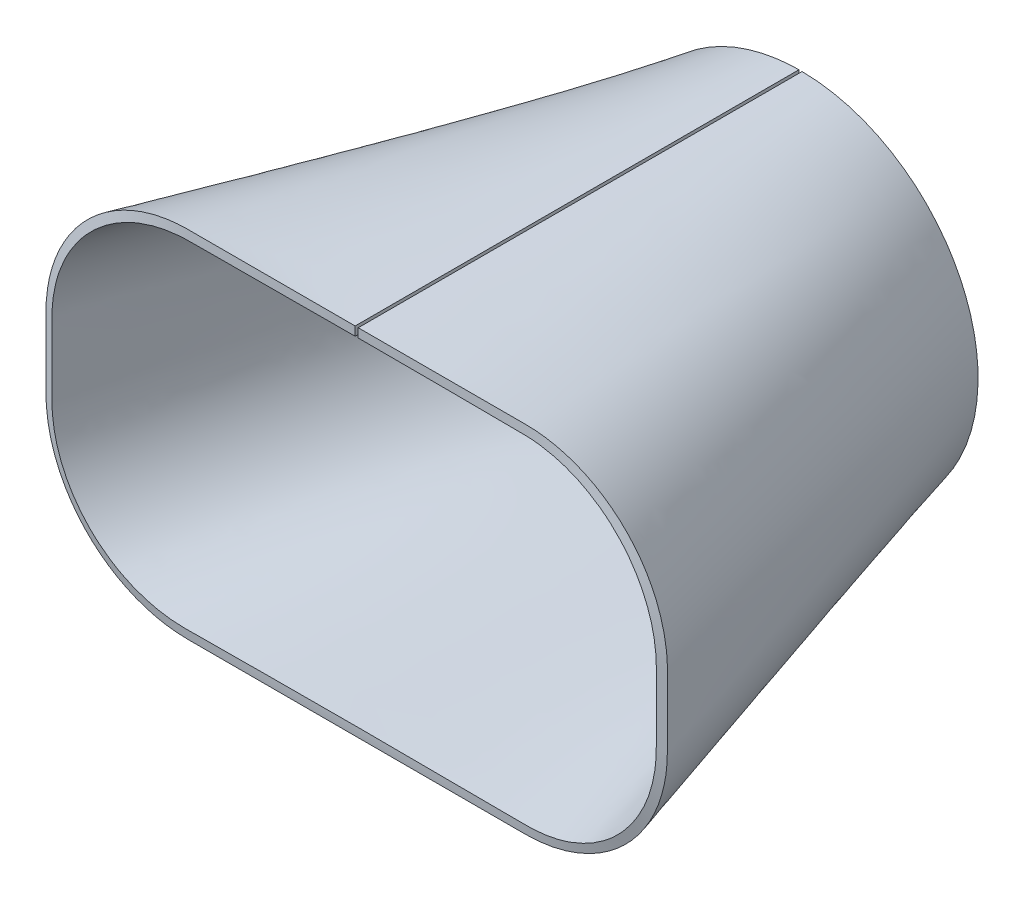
SolidWorks part; units mm, degrees
ref_plane "Ebene vorne" through (0, 0, 0) normal (0, 0, 1) x (1, 0, 0)
ref_plane "Ebene oben" through (0, 0, 0) normal (0, 1, 0) x (1, 0, 0)
ref_plane "Ebene rechts" through (0, 0, 0) normal (1, 0, 0) x (0, 0, -1)
sketch "Skizze1" plane through (0, 0, 0) normal (0, 0, 1) x (1, 0, 0)
  line L0 (0, 0) -> (0, 92.1391) construction
  line L1 (0.4363, 49.9981) -> (0, 0) construction
  line L2 (-0.4363, 49.9981) -> (0, 0) construction
  arc A0 (0.4363, 49.9981) -> (-0.4363, 49.9981) centre (0, 0) cw
  dimension "D1" = 50
  dimension "D2" = 0.5
  dimension "D3" = 1
ref_plane "Ebene1" through (0, 0, 250) normal (0, 0, 1) x (1, 0, 0)
sketch "Skizze2" plane through (0, 0, 250) normal (0, 0, 1) x (1, 0, 0)
  line L0 (0, 0) -> (-0.8636, 98.9627) construction
  line L1 (190, -62.5) -> (-190, -62.5)
  line L2 (250, -2.5) -> (250, 2.5)
  line L3 (190, 62.5) -> (0.5454, 62.5)
  line L4 (-250, -2.5) -> (-250, 2.5)
  line L5 (250, -62.5) -> (-250, 62.5) construction
  line L6 (250, 62.5) -> (-250, -62.5) construction
  line L7 (-0.8636, 98.9627) -> (0.8636, 98.9627) construction
  line L8 (0.8636, 98.9627) -> (0, 0) construction
  line L9 (0, 0) -> (0, 92.1391) construction
  line L10 (-0.5454, 62.5) -> (-190, 62.5)
  arc A0 (-190, 62.5) -> (-250, 2.5) centre (-190, 2.5) ccw
  arc A1 (-190, -62.5) -> (-250, -2.5) centre (-190, -2.5) cw
  arc A2 (250, 2.5) -> (190, 62.5) centre (190, 2.5) ccw
  arc A3 (190, -62.5) -> (250, -2.5) centre (190, -2.5) ccw
  point P0 (0, 0)
  dimension "D3" = 60
  dimension "D1" = 125
  dimension "D2" = 500
  dimension "D4" = 0.5
  dimension "D5" = 1
sheet metal parameters "Blech1" thickness 2.5 parameters "D1"=0, "Dicke"=2.5
ref_plane "Ebene2" through (0, 0, 125) normal (0, 0, 1) x (1, 0, 0)
sketch "Skizze4" plane through (0, 0, 125) normal (0, 0, 1) x (1, 0, 0)
  line L0 (0, 0) -> (-0.5454, 62.5) construction
  line L1 (47.5, -50) -> (-47.5, -50)
  line L2 (87.5, -10) -> (87.5, 10)
  line L3 (47.5, 50) -> (0.4363, 50)
  line L4 (-87.5, -10) -> (-87.5, 10)
  line L5 (87.5, -50) -> (-87.5, 50) construction
  line L6 (87.5, 50) -> (-87.5, -50) construction
  line L7 (-0.5454, 62.5) -> (0.5454, 62.5) construction
  line L8 (0.5454, 62.5) -> (0, 0) construction
  line L9 (-0.4363, 50) -> (-47.5, 50)
  arc A0 (-47.5, 50) -> (-87.5, 10) centre (-47.5, 10) ccw
  arc A1 (-47.5, -50) -> (-87.5, -10) centre (-47.5, -10) cw
  arc A2 (47.5, -50) -> (87.5, -10) centre (47.5, -10) ccw
  arc A3 (87.5, 10) -> (47.5, 50) centre (47.5, 10) ccw
  point P0 (0, 0)
  dimension "D3" = 40
  dimension "D1" = 100
  dimension "D2" = 175
lofted bend "Ausgeformte Biegungen2" parameters "D1"=0, "D12"=2.5
other "Freiform-Biegung2" parameters "D1"=1000, "D4"=57.296, "D5"=1
sketch "Skizze6" plane through (0, 0, 125) normal (0, 0, 1) x (1, 0, 0)
  line L0 (0, 0) -> (-0.5454, 62.5) construction
  line L1 (47.5, -50) -> (-47.5, -50)
  line L2 (87.5, -10) -> (87.5, 10)
  line L3 (47.5, 50) -> (0.4363, 50)
  line L4 (-87.5, -10) -> (-87.5, 10)
  line L5 (87.5, -50) -> (-87.5, 50) construction
  line L6 (87.5, 50) -> (-87.5, -50) construction
  line L7 (-0.5454, 62.5) -> (0.5454, 62.5) construction
  line L8 (0.5454, 62.5) -> (0, 0) construction
  line L9 (-0.4363, 50) -> (-47.5, 50)
  arc A0 (-47.5, 50) -> (-87.5, 10) centre (-47.5, 10) ccw
  arc A1 (-47.5, -50) -> (-87.5, -10) centre (-47.5, -10) cw
  arc A2 (47.5, -50) -> (87.5, -10) centre (47.5, -10) ccw
  arc A3 (87.5, 10) -> (47.5, 50) centre (47.5, 10) ccw
  point P0 (0, 0)
  dimension "D3" = 40
  dimension "D1" = 100
  dimension "D2" = 175
ref_plane "Ebene3" through (0, 0, 375) normal (0, 0, 1) x (1, 0, 0)
sketch "Skizze7" plane through (0, 0, 375) normal (0, 0, 1) x (1, 0, 0)
  line L0 (0, 0) -> (-1.0326, 118.329) construction
  line L1 (285, 100) -> (0.8727, 100)
  line L2 (375, 10) -> (375, -10)
  line L3 (285, -100) -> (-285, -100)
  line L4 (-375, 10) -> (-375, -10)
  line L5 (375, 100) -> (-375, -100) construction
  line L6 (375, -100) -> (-375, 100) construction
  line L7 (87.5, 50) -> (-87.5, -50) construction
  line L8 (-1.0326, 118.329) -> (1.0326, 118.329) construction
  line L9 (1.0326, 118.329) -> (0, 0) construction
  line L10 (0, 0) -> (-0.8636, 98.9627) construction
  line L11 (0.8636, 98.9627) -> (0, 0) construction
  line L12 (-0.8727, 100) -> (-285, 100)
  arc A0 (-285, 100) -> (-375, 10) centre (-285, 10) ccw
  arc A1 (-285, -100) -> (-375, -10) centre (-285, -10) cw
  arc A2 (375, -10) -> (285, -100) centre (285, -10) cw
  arc A3 (285, 100) -> (375, 10) centre (285, 10) cw
  point P0 (0, 0)
  dimension "D3" = 90
  dimension "D1" = 200
  dimension "D2" = 750
flat pattern "Abwicklung2"
sketch "Biegung-Linien2" plane through (0, 0, 0) normal (0, 1, 0) x (-1, 0, 0)
other "Abwickeln-<Freiform-Biegung2>1"
